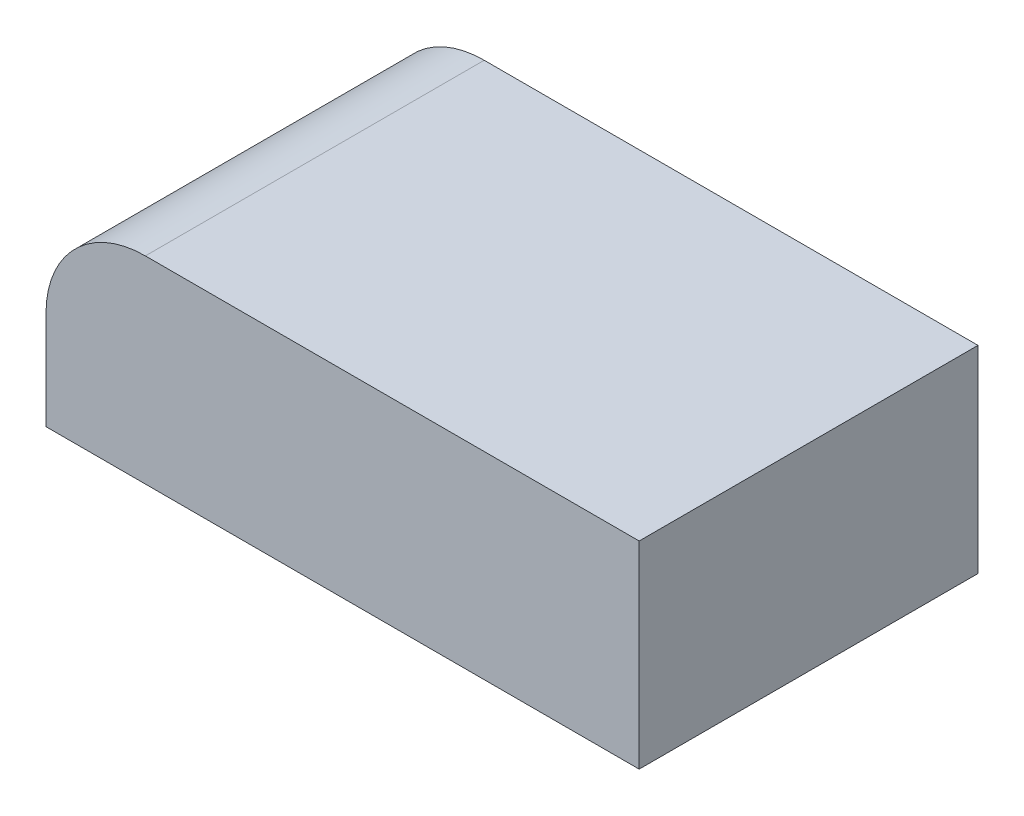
SolidWorks part; units mm, degrees
ref_plane "Ebene vorne" through (0, 0, 0) normal (0, 0, 1) x (1, 0, 0)
ref_plane "Ebene oben" through (0, 0, 0) normal (0, 1, 0) x (1, 0, 0)
ref_plane "Ebene rechts" through (0, 0, 0) normal (1, 0, 0) x (0, 0, -1)
sketch "Skizze1" plane through (0, 0, 0) normal (0, 0, 1) x (1, 0, 0)
  line L0 (0, 0) -> (0, 15.9463)
  line L1 (16.1297, 32.076) -> (96.2822, 32.076)
  line L2 (96.2822, 32.076) -> (96.2822, 0)
  line L3 (96.2822, 0) -> (0, 0)
  arc A0 (0, 15.9463) -> (16.1297, 32.076) centre (16.1297, 15.9463) cw
extrude "Linear austragen1" add sketch "Skizze1" against normal blind 55
sketch "Skizze2" [suppressed] plane through (0, 0, 0) normal (0, 0, 1) x (1, 0, 0)
  line L4 (0, 15.9463) -> (0, 0)
  line L5 (96.2822, 32.076) -> (16.1297, 32.076)
  line L6 (96.2822, 0) -> (96.2822, 32.076)
  line L7 (0, 0) -> (96.2822, 0)
  line L8 (0, 15.9463) -> (0, 0) construction
  line L9 (96.2822, 32.076) -> (16.1297, 32.076) construction
  line L10 (96.2822, 0) -> (96.2822, 32.076)
  line L11 (0, 0) -> (96.2822, 0)
  arc A1 (16.1297, 32.076) -> (0, 15.9463) centre (16.1297, 15.9463) ccw
  arc A2 (16.1297, 32.076) -> (0, 15.9463) centre (16.1297, 15.9463) ccw construction
  spline S0 degree 3 poles (96.2822, 32.076) (69.9426, 32.076) (43.6031, 32.076) (17.2636, 32.076) (17.1376, 32.076) (16.8856, 32.076) (16.5077, 32.076) (16.2557, 32.076) (16.1297, 32.076) (16.0029, 32.076) (15.7494, 32.076) (15.3691, 32.0595) (15.1159, 32.0446) (14.9895, 32.0356) (6.8566, 31.4593) (0.9823, 25.8052) (0.0957, 17.7003) (0.0744, 17.5062) (0.039, 17.1174) (0, 16.5318) (0, 16.1415) (0, 15.9463) (0, 15.7523) (0, 15.3642) (0, 14.7822) (0, 14.3941) (0, 14.2001) (0, 9.4667) (0, 4.7334) (0, 0) knots 0 0 0 0 0.660314 0.660314 0.660314 0.663472 0.66663 0.669789 0.669789 0.669789 0.672967 0.676145 0.679323 0.679323 0.679323 0.852067 0.852067 0.852067 0.85696 0.861853 0.866746 0.866746 0.866746 0.87161 0.876474 0.881338 0.881338 0.881338 1 1 1 1 weights 1 1 1 1 1 1 1 1 1 1 1 1 1 1 0.845137 0.845137 1 1 1 1 1 1 1 1 1 1 1 1 1 1
  dimension "D1" = 0
extrude "Linear austragen2" [suppressed] add sketch "Skizze2" against normal blind 55
equation "\"LÄNGE\"=0"
equation "\"BREITE\"=0"
equation "\"HÖHE\"=0"
equation "\"DURCHMESSER\"=0"
equation "\"Stückzahl\"= 1"
